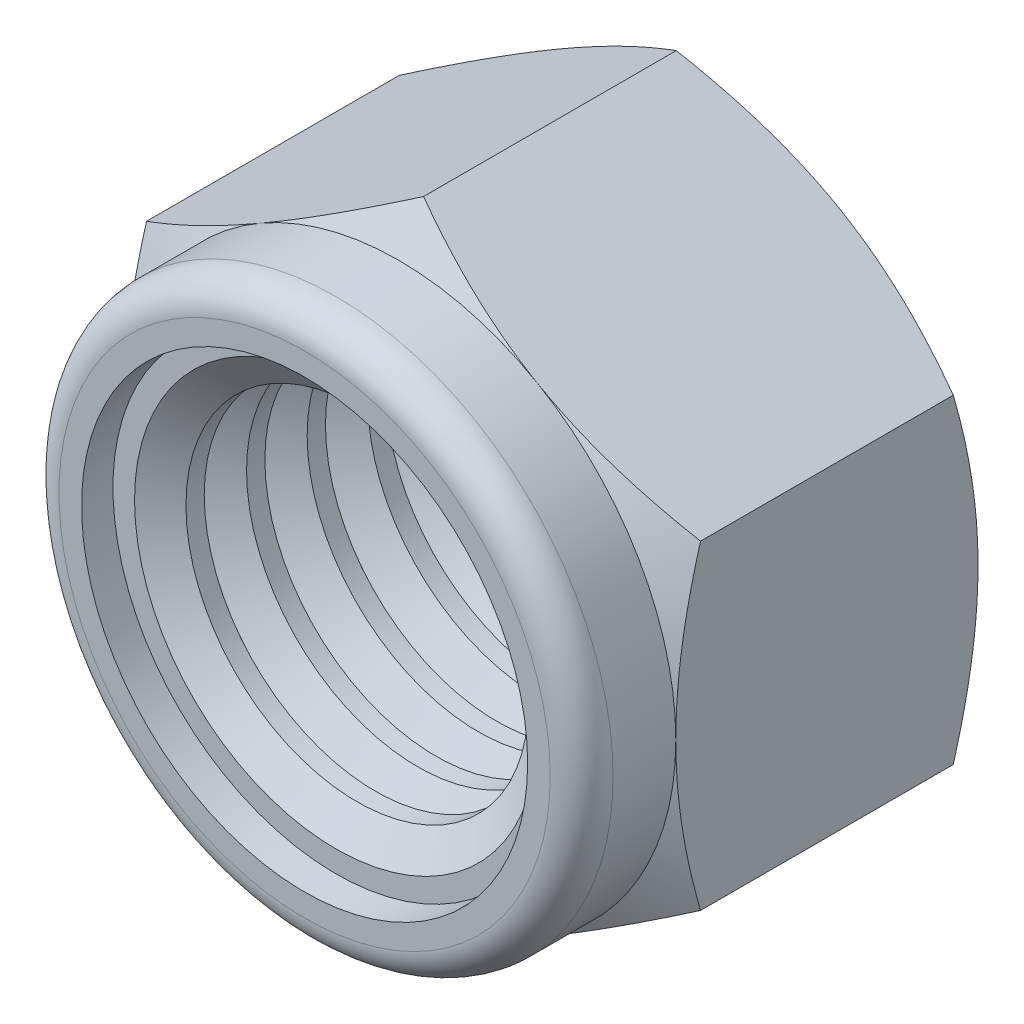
SolidWorks part; units mm, degrees
ref_plane "Plane1" through (0, 0, 0) normal (0, 0, 1) x (1, 0, 0)
ref_plane "Plane2" through (0, 0, 0) normal (0, 1, 0) x (1, 0, 0)
ref_plane "Plane3" through (0, 0, 0) normal (1, 0, 0) x (0, 0, -1)
revolve "EndChamfer" cut sketch "Sketch5"
sketch "Sketch5"
extrude "BaseNut" add sketch "BaseNutSke" against normal blind 6
sketch "BaseNutSke" plane through (0, 0, 0) normal (0, 0, 1) x (1, 0, 0)
  line L6 (5.5, 3.1754) -> (5.5, -3.1754)
  line L7 (-5.5, 3.1754) -> (-5.5, -3.1754)
  line L8 (5.5, 3.1754) -> (0, 6.3509)
  line L9 (0, 6.3509) -> (-5.5, 3.1754)
  line L10 (-5.5, -3.1754) -> (0, -6.3509)
  line L11 (0, -6.3509) -> (5.5, -3.1754)
  circle A0 centre (0, 0) radius 3.4
  circle A1 centre (0, 0) radius 4 construction
  dimension "D4" = 5.5
  dimension "Tap_drill" = 6.8
  dimension "Major_thd" = 8
  dimension "D1" = 120
  dimension "D2" = 5.5
  dimension "D3" = 5.5
  dimension "Width_flats" = 11
pattern_linear "ThdSchPat" count 6 spacing 1.2035 along (0, 0, -1)
revolve "ThreadSchematic" cut sketch "ThdSchSke"
sketch "ThdSchSke"
  line L0 (-4, -1.2467) -> (-3.4, -0.8265)
  line L1 (-3.4, -0.8265) -> (-1.7, -0.8265)
  line L2 (-1.7, -0.8265) -> (-1.7, -1.6668)
  line L3 (-1.7, -1.6668) -> (-3.4, -1.6668)
  line L4 (-3.4, -1.6668) -> (-4, -1.2467)
  line L5 (-3.175, 0.0033) -> (3.175, 0.0033) construction
  line L6 (0, 0.0033) -> (0, -2.9874) construction
  line L7 (0, 5.5545) -> (0, -1.2467) construction
  line L8 (5.5, -1.2467) -> (-5.5, -1.2467) construction
revolve "TorqueElement" add sketch "TorElSke"
sketch "TorElSke"
  line L0 (-9.4809, 0) -> (15.875, 0) construction
  line L1 (5.5545, 0) -> (0.4201, 0) construction
  line L2 (-1.2467, 3.4) -> (3, 3.4)
  line L3 (3, 3.4) -> (3, 5.5)
  line L4 (3, 5.5) -> (-1.2467, 5.5)
  line L5 (-1.2467, 3.4) -> (-1.2467, 4.4286)
  line L6 (-1.2467, 4.4286) -> (-1.87, 4.4286)
  line L7 (-1.87, 4.4286) -> (-1.87, 4.8767)
  line L8 (6, -4.7631) -> (6, 0) construction
  arc A0 (-1.87, 4.8767) -> (-1.2467, 5.5) centre (-1.2467, 4.8767) cw
revolve "Double-Chamfer" cut sketch "Sketch3" angle 360 about L7
sketch "Sketch3" plane through (0, 0, 0) normal (1, 0, 0) x (0, 0, -1)
  line L0 (6, 5.5) -> (5.5088, 6.3509)
  line L1 (5.5088, 6.3509) -> (5.5088, 16.3509)
  line L2 (5.5088, 16.3509) -> (16, 16.3509)
  line L3 (16, 16.3509) -> (16, 5.5)
  line L4 (16, 5.5) -> (6, 5.5)
  line L5 (6, 3.1754) -> (6, 6.3509) construction
  line L6 (6, 6.3509) -> (0, 6.3509) construction
  line L7 (0, 0) -> (38.6776, 0) construction
  line L8 (6, 0) -> (0, 0) construction
  line L9 (3, 6.3509) -> (3, 44.222) construction
  line L10 (0.4912, 16.3509) -> (-10, 16.3509)
  line L11 (-10, 16.3509) -> (-10, 5.5)
  line L12 (-10, 5.5) -> (0, 5.5)
  line L13 (0, 5.5) -> (0.4912, 6.3509)
  line L14 (0.4912, 6.3509) -> (0.4912, 16.3509)
  line L16 (6, 6.3509) -> (0, 6.3509) construction
  dimension "D1" = 5.5
  dimension "D2" = 30
  dimension "D3" = 10
  dimension "D4" = 10
equation "\"Thread_major@ThreadCosmetic\" = \"Major_thd@BaseNutSke\""
equation "\"D2@BaseNutSke\" = \"Width_flats@BaseNutSke\" / 2"
equation "\"D3@BaseNutSke\" = \"Width_flats@BaseNutSke\" / 2"
equation "\"D1@Sketch3\" = \"Width_flats@BaseNutSke\" /2"
equation "\"D4@BaseNutSke\" = \"D3@BaseNutSke\""
equation "\"Thread_major@ThdSchSke\" = \"Major_thd@BaseNutSke\""
equation "\"Tap_drill@ThdSchSke\" = \"Tap_drill@BaseNutSke\""
equation "\"Overcut@ThdSchSke\" = \"Tap_drill@ThdSchSke\" * 0.5"
equation "\"Num_threads@ThdSchPat\" = int(  ( \"Thickness1@BaseNut\" - 0.0508 ) / \"Advance@ThdSchSke\" + 0.999 )  + 1"
equation "\"Advance@ThdSchPat\" = ( \"Thickness1@BaseNut\" - 0.0508 ) /  (\"Num_threads@ThdSchPat\" - 1) 'relax it"
equation "' \"Num_threads@ThdSchPat\" = \"Num_threads@ThdSchPat\" - sgn( \"Num_threads@ThdSchPat\" - 1) '---chamfered tips only---"
equation "\"ThreadMajor@Sketch5\" = \"Major_thd@BaseNutSke\"  * 0.5"
equation "\"ChamferDepth@Sketch5\" = (\"Major_thd@BaseNutSke\" - \"Tap_drill@BaseNutSke\") * 0.55"
equation "\"Offset1@Sketch5\" = \"Thickness1@BaseNut\" + 0.0254"
equation "\"Offset2@Sketch5\" = \"Offset1@Sketch5\" + 0.0508"
equation "\"Overlap@TorElSke\" = \"Thickness1@BaseNut\" / 2"
equation "\"Diameter@TorElSke\" = \"Width_flats@BaseNutSke\""
equation "\"Thread_min@TorElSke\" = \"Tap_drill@BaseNutSke\""
equation "\"Inset_Dia@TorElSke\" = \"Thread_major@ThreadCosmetic\" +  ( 1 / 3.5 )  * (\"Diameter@TorElSke\" - \"Thread_major@ThreadCosmetic\")"
equation "\"Inset_Dep@TorElSke\" =  ( \"Thickness2@TorElSke\" - \"Thickness1@BaseNut\" )  / 3"
equation "\"Fillet_rad@TorElSke\" = \"Inset_Dep@TorElSke\""
equation "\"Num_threads@ThdSchPat\" = int (  ( \"Thickness2@TorElSke\" - \"Inset_Dep@TorElSke\" - 0.0254 )  / \"Advance@ThdSchSke\" + 0.999 )  + 1"
equation "\"Advance@ThdSchPat\" =  ( \"Thickness2@TorElSke\" - \"Inset_Dep@TorElSke\" - 0.0254 )  /  ( \"Num_threads@ThdSchPat\" - 1 ) 'relax it"
